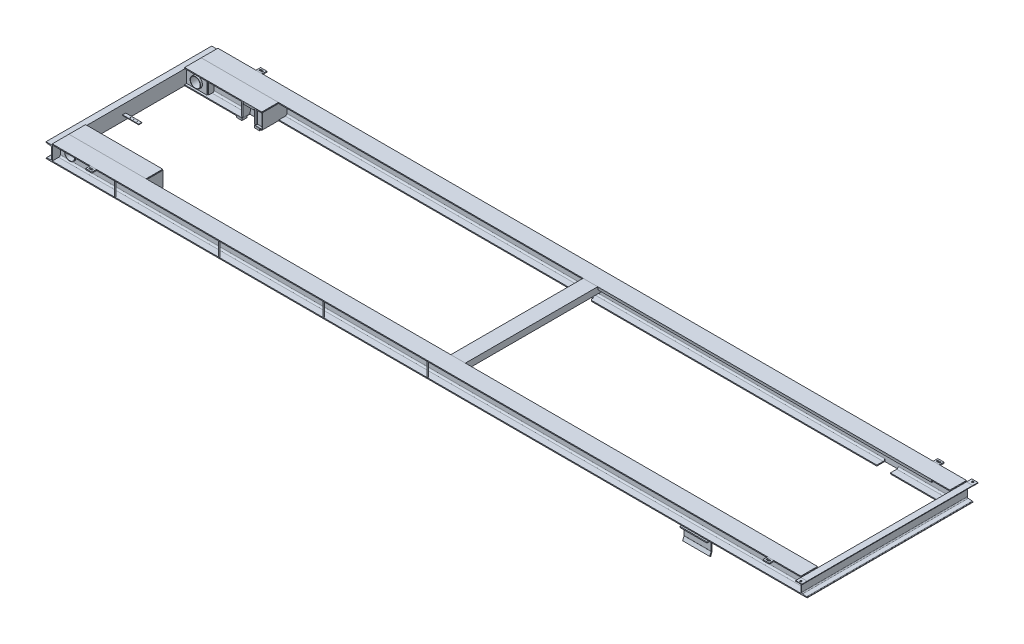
SolidWorks part; units mm, degrees
ref_plane "Plan de face" through (0, 0, 0) normal (0, 0, 1) x (1, 0, 0)
ref_plane "Plan de dessus" through (0, 0, 0) normal (0, 1, 0) x (1, 0, 0)
ref_plane "Plan de droite" through (0, 0, 0) normal (1, 0, 0) x (0, 0, -1)
sketch3d "Esquisse3D1"
  line L0 (0, 0, 795) -> (0, 0, -795)
  line L1 (0, 0, 795) -> (7185, 0, 795)
  line L2 (7185, 0, 795) -> (7185, 0, -795)
  line L3 (7185, 0, -795) -> (0, 0, -795)
  line L4 (0, 0, 635) -> (740.5, 0, 635)
  line L5 (0, 0, -635) -> (740.5, 0, -635)
  point P2 (0, 0, 0)
  dimension "D1" = 1590
  dimension "D2" = 7185
  dimension "D3" = 1270
  dimension "D4" = 635
  dimension "D5" = 740.5
other "Elément mécano-soudé1"
ref_plane "Plan1" through (0, 0, 795) normal (1, 0, 0) x (0, 0, -1)
sketch "Esquisse2" plane through (0, 0, 715) normal (1, 0, 0) x (0, 0, -1)
  line L0 (0, 152) -> (0, 0) construction
  line L1 (80, 0) -> (-80, 0)
  line L2 (-80, 0) -> (-80, 9)
  line L3 (-80, 9) -> (-18, 9)
  line L4 (-3, 24) -> (-3, 128)
  line L5 (-18, 143) -> (-80, 143)
  line L6 (-80, 143) -> (-80, 152)
  line L7 (-80, 152) -> (80, 152)
  line L8 (80, 143) -> (80, 152)
  line L9 (18, 143) -> (80, 143)
  line L10 (3, 24) -> (3, 128)
  line L11 (80, 9) -> (18, 9)
  line L12 (80, 0) -> (80, 9)
  arc A0 (-18, 9) -> (-3, 24) centre (-18, 24) ccw
  arc A1 (-3, 128) -> (-18, 143) centre (-18, 128) ccw
  arc A2 (3, 128) -> (18, 143) centre (18, 128) cw
  arc A3 (18, 9) -> (3, 24) centre (18, 24) cw
  point P2 (0, 76)
  point P22 (0, 152)
  point P25 (0, 0)
  point P26 (-80, 76)
  point P27 (80, 76)
  point P28 (0, 0)
  dimension "D5" = 15
  dimension "D1" = 6
  dimension "D3" = 160
  dimension "D6" = 152
  dimension "D7" = 9
other "Elément mécano-soudé2"
ref_plane "Plan2" through (7185, 0, -795) normal (-1, 0, 0) x (0, 0, 1)
sketch "Esquisse21" plane through (7185, 0, -715) normal (-1, 0, 0) x (0, 0, 1)
  line L0 (0, 152) -> (0, 0) construction
  line L1 (80, 0) -> (-80, 0)
  line L2 (-80, 0) -> (-80, 9)
  line L3 (-80, 9) -> (-18, 9)
  line L4 (-3, 24) -> (-3, 128)
  line L5 (-18, 143) -> (-80, 143)
  line L6 (-80, 143) -> (-80, 152)
  line L7 (-80, 152) -> (80, 152)
  line L8 (80, 143) -> (80, 152)
  line L9 (18, 143) -> (80, 143)
  line L10 (3, 24) -> (3, 128)
  line L11 (80, 9) -> (18, 9)
  line L12 (80, 0) -> (80, 9)
  arc A0 (-18, 9) -> (-3, 24) centre (-18, 24) ccw
  arc A1 (-3, 128) -> (-18, 143) centre (-18, 128) ccw
  arc A2 (3, 128) -> (18, 143) centre (18, 128) cw
  arc A3 (18, 9) -> (3, 24) centre (18, 24) cw
  point P2 (0, 76)
  point P22 (0, 152)
  point P25 (0, 0)
  point P26 (-80, 76)
  point P27 (80, 76)
  point P28 (0, 0)
  dimension "D5" = 15
  dimension "D1" = 6
  dimension "D3" = 160
  dimension "D6" = 152
  dimension "D7" = 9
other "Elément mécano-soudé3"
ref_plane "Plan3" through (0, 0, -635) normal (1, 0, 0) x (0, 0, -1)
sketch "Esquisse22" plane through (0, 0, -555) normal (1, 0, 0) x (0, 0, -1)
  line L0 (0, 152) -> (0, 0) construction
  line L1 (80, 0) -> (-80, 0)
  line L2 (-80, 0) -> (-80, 9)
  line L3 (-80, 9) -> (-18, 9)
  line L4 (-3, 24) -> (-3, 128)
  line L5 (-18, 143) -> (-80, 143)
  line L6 (-80, 143) -> (-80, 152)
  line L7 (-80, 152) -> (80, 152)
  line L8 (80, 143) -> (80, 152)
  line L9 (18, 143) -> (80, 143)
  line L10 (3, 24) -> (3, 128)
  line L11 (80, 9) -> (18, 9)
  line L12 (80, 0) -> (80, 9)
  arc A0 (-18, 9) -> (-3, 24) centre (-18, 24) ccw
  arc A1 (-3, 128) -> (-18, 143) centre (-18, 128) ccw
  arc A2 (3, 128) -> (18, 143) centre (18, 128) cw
  arc A3 (18, 9) -> (3, 24) centre (18, 24) cw
  point P2 (0, 76)
  point P22 (0, 152)
  point P25 (0, 0)
  point P26 (-80, 76)
  point P27 (80, 76)
  point P28 (0, 0)
  dimension "D5" = 15
  dimension "D1" = 6
  dimension "D3" = 160
  dimension "D6" = 152
  dimension "D7" = 9
other "Elément mécano-soudé4"
ref_plane "Plan4" through (0, 0, 635) normal (1, 0, 0) x (0, 0, -1)
sketch "Esquisse23" plane through (0, 0, 555) normal (1, 0, 0) x (0, 0, -1)
  line L0 (0, 152) -> (0, 0) construction
  line L1 (80, 0) -> (-80, 0)
  line L2 (-80, 0) -> (-80, 9)
  line L3 (-80, 9) -> (-18, 9)
  line L4 (-3, 24) -> (-3, 128)
  line L5 (-18, 143) -> (-80, 143)
  line L6 (-80, 143) -> (-80, 152)
  line L7 (-80, 152) -> (80, 152)
  line L8 (80, 143) -> (80, 152)
  line L9 (18, 143) -> (80, 143)
  line L10 (3, 24) -> (3, 128)
  line L11 (80, 9) -> (18, 9)
  line L12 (80, 0) -> (80, 9)
  arc A0 (-18, 9) -> (-3, 24) centre (-18, 24) ccw
  arc A1 (-3, 128) -> (-18, 143) centre (-18, 128) ccw
  arc A2 (3, 128) -> (18, 143) centre (18, 128) cw
  arc A3 (18, 9) -> (3, 24) centre (18, 24) cw
  point P2 (0, 76)
  point P22 (0, 152)
  point P25 (0, 0)
  point P26 (-80, 76)
  point P27 (80, 76)
  point P28 (0, 0)
  dimension "D5" = 15
  dimension "D1" = 6
  dimension "D3" = 160
  dimension "D6" = 152
  dimension "D7" = 9
other "Elément mécano-soudé5"
ref_plane "Plan5" through (0, 0, 795) normal (0, 0, -1) x (-1, 0, 0)
sketch "Esquisse1" plane through (0, 0, 795) normal (0, 0, -1) x (-1, 0, 0)
  line L0 (60, 140) -> (0, 140)
  line L1 (60, 0) -> (0, 0)
  line L2 (0, 140) -> (0, 0)
  line L3 (60, 140) -> (60, 136.8833)
  line L4 (60, 0) -> (60, 3.1167)
  line L5 (7, 119) -> (7, 21)
  line L6 (16.2543, 128.9722) -> (55.3728, 131.8973)
  line L7 (16.2543, 11.0278) -> (55.3728, 8.1027)
  arc A0 (7, 21) -> (16.2543, 11.0278) centre (17, 21) ccw
  arc A1 (7, 119) -> (16.2543, 128.9722) centre (17, 119) cw
  arc A2 (60, 3.1167) -> (55.3728, 8.1027) centre (55, 3.1167) ccw
  arc A3 (60, 136.8833) -> (55.3728, 131.8973) centre (55, 136.8833) cw
  point P15 (60, 132.2433)
  point P18 (60, 7.7567)
  point P19 (0, 70)
  point P20 (7, 70)
  point P21 (30, 140)
  point P22 (30, 0)
  point P23 (0, 140)
  point P24 (0, 0)
  point P25 (7, 128.2802)
  point P26 (30, 130)
  point P27 (30, 70)
  point P28 (60, 70)
  point P29 (7, 11.7198)
  point P30 (30, 10)
  point P31 (0, 0)
  dimension "D1" = 140
  dimension "D2" = 98
  dimension "D8" = 5
  dimension "D7" = 10
  dimension "D9" = 11.0278
  dimension "D3" = 60
  dimension "D4" = 10
  dimension "D5" = 10
  dimension "D6" = 7
other "Elément mécano-soudé6"
ref_plane "Plan6" through (7185, 0, 795) normal (0, 0, -1) x (-1, 0, 0)
sketch "Esquisse11" plane through (7185, 140, 795) normal (0, 0, -1) x (1, 0, 0)
  line L0 (60, 140) -> (0, 140)
  line L1 (60, 0) -> (0, 0)
  line L2 (0, 140) -> (0, 0)
  line L3 (60, 140) -> (60, 136.8833)
  line L4 (60, 0) -> (60, 3.1167)
  line L5 (7, 119) -> (7, 21)
  line L6 (16.2543, 128.9722) -> (55.3728, 131.8973)
  line L7 (16.2543, 11.0278) -> (55.3728, 8.1027)
  arc A0 (7, 21) -> (16.2543, 11.0278) centre (17, 21) ccw
  arc A1 (7, 119) -> (16.2543, 128.9722) centre (17, 119) cw
  arc A2 (60, 3.1167) -> (55.3728, 8.1027) centre (55, 3.1167) ccw
  arc A3 (60, 136.8833) -> (55.3728, 131.8973) centre (55, 136.8833) cw
  point P15 (60, 132.2433)
  point P18 (60, 7.7567)
  point P19 (0, 70)
  point P20 (7, 70)
  point P21 (30, 140)
  point P22 (30, 0)
  point P23 (0, 140)
  point P24 (0, 0)
  point P25 (7, 128.2802)
  point P26 (30, 130)
  point P27 (30, 70)
  point P28 (60, 70)
  point P29 (7, 11.7198)
  point P30 (30, 10)
  point P31 (0, 0)
  dimension "D1" = 140
  dimension "D2" = 98
  dimension "D8" = 5
  dimension "D7" = 10
  dimension "D9" = 11.0278
  dimension "D3" = 60
  dimension "D4" = 10
  dimension "D5" = 10
  dimension "D6" = 7
sketch3d "Esquisse3D2"
  line L0 (3805, 152, 795) -> (3805, 152, -795)
  line L1 (7185, 152, 795) -> (0, 152, 795) construction
  line L2 (0, 152, -795) -> (7185, 152, -795) construction
  dimension "D1" = 3380
other "Elément mécano-soudé7"
ref_plane "Plan7" through (3805, 152, 795) normal (0, 0, -1) x (-1, 0, 0)
sketch "Esquisse12" plane through (3805, 152, 795) normal (0, 0, -1) x (0, -1, 0)
  line L0 (60, 140) -> (0, 140)
  line L1 (60, 0) -> (0, 0)
  line L2 (0, 140) -> (0, 0)
  line L3 (60, 140) -> (60, 136.8833)
  line L4 (60, 0) -> (60, 3.1167)
  line L5 (7, 119) -> (7, 21)
  line L6 (16.2543, 128.9722) -> (55.3728, 131.8973)
  line L7 (16.2543, 11.0278) -> (55.3728, 8.1027)
  arc A0 (7, 21) -> (16.2543, 11.0278) centre (17, 21) ccw
  arc A1 (7, 119) -> (16.2543, 128.9722) centre (17, 119) cw
  arc A2 (60, 3.1167) -> (55.3728, 8.1027) centre (55, 3.1167) ccw
  arc A3 (60, 136.8833) -> (55.3728, 131.8973) centre (55, 136.8833) cw
  point P15 (60, 132.2433)
  point P18 (60, 7.7567)
  point P19 (0, 70)
  point P20 (7, 70)
  point P21 (30, 140)
  point P22 (30, 0)
  point P23 (0, 140)
  point P24 (0, 0)
  point P25 (7, 128.2802)
  point P26 (30, 130)
  point P27 (30, 70)
  point P28 (60, 70)
  point P29 (7, 11.7198)
  point P30 (30, 10)
  point P31 (0, 0)
  dimension "D1" = 140
  dimension "D2" = 98
  dimension "D8" = 5
  dimension "D7" = 10
  dimension "D9" = 11.0278
  dimension "D3" = 60
  dimension "D4" = 10
  dimension "D5" = 10
  dimension "D6" = 7
other "Ajuster/Prolonger1"
sketch3d "Esquisse3D3"
  line L0 (3805, 143, 640) -> (7005, 143, 640)
  dimension "D1" = 3200
  dimension "D2" = 5
other "Elément mécano-soudé8"
ref_plane "Plan8" through (3805, 143, 640) normal (1, 0, 0) x (0, 0, -1)
sketch "Esquisse13" plane through (3805, 123, 665) normal (1, 0, 0) x (0, 0, -1)
  line L1 (-25, 0) -> (25, 0)
  line L2 (-25, 0) -> (-25, 20)
  line L3 (-25, 20) -> (25, 20)
  line L4 (25, 0) -> (25, 20)
  point P4 (0, 0)
  point P5 (0, 0)
  dimension "D1" = 20
  dimension "D2" = 50
sketch "Esquisse24" plane through (0, 0, 0) normal (0, -1, 0) x (1, 0, 0)
  line L0 (740.5, 475) -> (0, 475) construction
  line L1 (670, 475) -> (550, 475)
  line L2 (670, 475) -> (670, 552)
  line L3 (670, 552) -> (550, 552)
  line L4 (550, 475) -> (550, 552)
  line L5 (0, 795) -> (0, -795) construction
  dimension "D1" = 120
  dimension "D2" = 77
  dimension "D3" = 550
extrude "Enlèv. mat.-Extru.1" cut sketch "Esquisse24" against normal blind 30
inserted part "CA2502-6"
move or copy body "Corps-Déplacer/Copier2" placed by mates yes
other "<CA2502-6>-<Chanfrein1>"
inserted part "CA2502-5"
move or copy body "Corps-Déplacer/Copier4" placed by mates yes
other "Distance1" parameters "D1"=4.5
other "<CA2502-5>-<Chanfrein1>"
inserted part "CA2502-52"
move or copy body "Corps-Déplacer/Copier6" placed by mates yes
other "Distance2" parameters "D1"=111
other "<CA2502-5>-<Chanfrein1>"
inserted part "CA2502-8"
move or copy body "Corps-Déplacer/Copier8" placed by mates yes
other "Distance3" parameters "D1"=20
other "<CA2502-8>-<Extrusion1>"
inserted part "OB2865"
move or copy body "Corps-Déplacer/Copier10" placed by mates yes
other "Distance4" parameters "D1"=4.5
other "<OB2865>-<Trou taraudé M121>"
pattern_linear "Répétition linéaire1" count 2 spacing 170
inserted part "CA2600-240"
move or copy body "Corps-Déplacer/Copier12" placed by mates yes
other "<CA2600-240>-<Enlèv. mat.-Extru.1>"
sketch "Esquisse25" plane through (0, 0, 552) normal (0, 0, -1) x (-1, 0, 0)
  circle A0 centre (-100, 75.5) radius 51.5
  circle A1 centre (-100, 75.5) radius 51.5 construction
extrude "Enlèv. mat.-Extru.2" cut sketch "Esquisse25" against normal up to surface (166 mm away)
inserted part "CA2502-23"
move or copy body "Corps-Déplacer/Copier14" placed by mates yes
other "Distance5" parameters "D1"=10
other "<CA2502-23>-<Extrusion1>"
inserted part "OB0183"
move or copy body "Corps-Déplacer/Copier16" placed by mates yes
other "Distance6" parameters "D1"=425
other "<OB0183>-<Enlèv. mat.-Extru.1>"
pattern_linear "Répétition linéaire2" count 2 spacing 6500
sketch "Esquisse26" plane through (0, 0, 0) normal (0, -1, 0) x (1, 0, 0)
  line L0 (7185, 795) -> (7185, 635) construction
  line L1 (6613.65, 635) -> (6483.65, 635)
  line L2 (6613.65, 635) -> (6613.65, 712)
  line L3 (6613.65, 712) -> (6483.65, 712)
  line L4 (6483.65, 635) -> (6483.65, 712)
  line L6 (7185, 635) -> (0, 635) construction
  dimension "D1" = 130
  dimension "D2" = 77
  dimension "D3" = 571.35
extrude "Enlèv. mat.-Extru.3" cut sketch "Esquisse26" against normal blind 30
ref_plane "Plan9" through (6298.65, 0, 0) normal (-1, 0, 0) x (0, 0, 1)
sketch "Esquisse27" plane through (6298.65, 0, 0) normal (-1, 0, 0) x (0, 0, 1)
  line L0 (810, 0) -> (760, 0)
  line L1 (795, 0) -> (-795, 0) construction
  line L2 (760, 0) -> (760, -100)
  line L3 (760, -100) -> (773.6808, -137.5877)
  line L4 (0, -91.85) -> (0, 91.85) construction
  dimension "D1" = 50
  dimension "D2" = 100
  dimension "D3" = 40
  dimension "D4" = 20
  dimension "D5" = 760
extrude "Extru.-Mince1" add sketch "Esquisse27" along normal blind 260 separate body thin
sketch3d "Esquisse3D5"
  line L0 (7230, 140, 742) -> (7230, 140, 842)
  line L1 (7185, 140, 795) -> (7245, 140, 795) construction
  dimension "D1" = 100
  dimension "D2" = 47
  dimension "D3" = 45
sketch3d "Esquisse3D9"
  line L0 (7005, 133, 712) -> (3805, 133, 712)
  dimension "D1" = 10
other "Elément mécano-soudé13"
ref_plane "Plan14" through (7005, 133, 712) normal (-1, 0, 0) x (0, 0, 1)
sketch "Esquisse17" plane through (7005, 123, 702) normal (-1, 0, 0) x (0, 0, 1)
  line L1 (-10, 10) -> (10, 10)
  line L2 (-10, 10) -> (-10, -10)
  line L3 (-10, -10) -> (10, -10)
  line L4 (10, 10) -> (10, -10)
  point P4 (0, -10)
  point P6 (10, 0)
  point P7 (-10, 0)
  point P8 (0, 10)
  point P9 (0, 0)
  dimension "D1" = 20
mirror "Symétrie1" about plane through (0, 0, 0) normal (0, 0, 1)
sketch "Esquisse30" plane through (0, 0, 0) normal (0, -1, 0) x (1, 0, 0)
  line L0 (0, -635) -> (7185, -635) construction
  line L1 (6613.65, -712) -> (6483.65, -712)
  line L2 (6613.65, -712) -> (6613.65, -635)
  line L3 (6613.65, -635) -> (6483.65, -635)
  line L4 (6483.65, -712) -> (6483.65, -635)
  line L5 (6613.65, 635) -> (6613.65, 712) construction
  dimension "D1" = 130
  dimension "D2" = 77
extrude "Enlèv. mat.-Extru.12" cut sketch "Esquisse30" against normal blind 30
sketch3d "Esquisse3D6"
  line L0 (265, 0, 775) -> (265, 0, 655)
  line L3 (0, 0, -795) -> (0, 0, 795) construction
  dimension "D1" = 265
  dimension "D2" = 20
  dimension "D3" = 120
other "Elément mécano-soudé10"
ref_plane "Plan11" through (265, 0, 775) normal (0, 0, -1) x (-1, 0, 0)
sketch "Esquisse28" plane through (265, 0, 775) normal (0, 0, -1) x (1, 0, 0)
  line L0 (-11.5, 0) -> (11.5, 0)
  line L1 (-14, 2.5) -> (-14, 8.5)
  line L2 (14, 2.5) -> (14, 8.5)
  line L3 (-11.5, 11) -> (-6, 11)
  line L4 (11.5, 11) -> (6, 11)
  line L5 (11.5, 9) -> (6, 9)
  line L6 (12, 2.5) -> (12, 8.5)
  line L7 (-11.5, 2) -> (11.5, 2)
  line L8 (-12, 2.5) -> (-12, 8.5)
  line L9 (-11.5, 9) -> (-6, 9)
  line L10 (-6, 9) -> (-6, 11)
  line L11 (6, 9) -> (6, 11)
  arc A0 (-11.5, 0) -> (-14, 2.5) centre (-11.5, 2.5) cw
  arc A1 (-14, 8.5) -> (-11.5, 11) centre (-11.5, 8.5) cw
  arc A2 (14, 8.5) -> (11.5, 11) centre (11.5, 8.5) ccw
  arc A3 (11.5, 0) -> (14, 2.5) centre (11.5, 2.5) ccw
  arc A4 (12, 8.5) -> (11.5, 9) centre (11.5, 8.5) ccw
  arc A5 (11.5, 2) -> (12, 2.5) centre (11.5, 2.5) ccw
  arc A6 (-11.5, 2) -> (-12, 2.5) centre (-11.5, 2.5) cw
  arc A7 (-12, 8.5) -> (-11.5, 9) centre (-11.5, 8.5) cw
  point P3 (0, 0)
  point P10 (-14, 0)
  point P13 (-14, 11)
  point P18 (14, 0)
  point P33 (0, 11)
  point P34 (0, 0)
  dimension "D4" = 2.5
  dimension "D5" = 2.5
  dimension "D1" = 28
  dimension "D2" = 11
  dimension "D3" = 8
  dimension "D6" = 2
sketch3d "Esquisse3D7"
  line L0 (600, 143, 790) -> (600, 9, 790)
  dimension "D1" = 5
  dimension "D2" = 600
other "Elément mécano-soudé11"
ref_plane "Plan12" through (600, 143, 790) normal (0, -1, 0) x (1, 0, 0)
sketch "Esquisse15" plane through (600, 143, 790) normal (0, -1, 0) x (1, 0, 0)
  circle A0 centre (0, 0) radius 5
  point P3 (0, 0)
  dimension "D1" = 10
pattern_linear "Répétition linéaire3" count 4 spacing 1000 along (1, 0, 0)
sketch3d "Esquisse3D8"
  line L0 (0, 50, 105) -> (155, 50, 105)
  dimension "D1" = 690
  dimension "D2" = 50
  dimension "D3" = 155
other "Elément mécano-soudé12"
ref_plane "Plan13" through (0, 50, 105) normal (1, 0, 0) x (0, 0, -1)
sketch "Esquisse16" plane through (0, 56, 120) normal (1, 0, 0) x (0, -1, 0)
  line L1 (0, 0) -> (6, 0)
  line L2 (0, 0) -> (0, 30)
  line L3 (0, 30) -> (6, 30)
  line L4 (6, 0) -> (6, 30)
  point P5 (0, 15)
  point P6 (3, 0)
  point P7 (6, 15)
  point P8 (3, 30)
  point P9 (3, 15)
  point P10 (0, 0)
  dimension "D1" = 6
  dimension "D2" = 30
sketch "Esquisse32" plane through (0, 56, 0) normal (0, 1, 0) x (1, 0, 0)
  line L0 (0, -105) -> (155, -105) construction
  line L1 (155, -90) -> (155, -120) construction
  circle A0 centre (62, -105) radius 3
  circle A1 centre (92, -105) radius 3
  circle A2 centre (125, -105) radius 3
  dimension "D2" = 33
  dimension "D3" = 30
  dimension "D4" = 6
  dimension "D1" = 30
extrude "Enlèv. mat.-Extru.14" cut sketch "Esquisse32" against normal up to surface (6 mm away)
sketch "Esquisse36" plane through (0, 140, 0) normal (0, 1, 0) x (1, 0, 0)
  line L0 (7215, -795) -> (7215, -845)
  line L3 (7245, 795) -> (7245, -795) construction
  dimension "D1" = 50
  dimension "D2" = 30
other "Elément mécano-soudé16"
ref_plane "Plan18" through (7215, 140, 795) normal (0, 0, 1) x (1, 0, 0)
sketch "Esquisse115" plane through (7215, 140, 795) normal (0, 0, 1) x (-1, 0, 0)
  line L1 (-30, 6) -> (30, 6)
  line L2 (-30, 6) -> (-30, 0)
  line L3 (-30, 0) -> (30, 0)
  line L4 (30, 6) -> (30, 0)
  point P4 (0, 0)
  point P6 (0, 0)
  dimension "D1" = 60
  dimension "D2" = 6
sketch "Esquisse113" plane through (0, 140, 0) normal (0, 1, 0) x (1, 0, 0)
  line L0 (7245, 795) -> (7245, -795) construction
  line L1 (7245, -845) -> (7185, -845) construction
  circle A0 centre (7215, -825) radius 8.5
  dimension "D1" = 17
  dimension "D2" = 30
  dimension "D3" = 20
extrude "Enlèv. mat.-Extru.16" cut sketch "Esquisse113" against normal blind 10
mirror "Symétrie3" about plane through (0, 0, 0) normal (0, 0, 1)
sketch "Esquisse116" plane through (0, 0, 0) normal (0, -1, 0) x (1, 0, 0)
  line L0 (740.5, -475) -> (0, -475) construction
  line L1 (550, -475) -> (670, -475)
  line L2 (550, -475) -> (550, -552)
  line L3 (550, -552) -> (670, -552)
  line L4 (670, -475) -> (670, -552)
  line L5 (0, -795) -> (0, 795) construction
  dimension "D1" = 77
  dimension "D2" = 550
  dimension "D3" = 120
extrude "Enlèv. mat.-Extru.17" cut sketch "Esquisse116" against normal blind 30
mirror "Symétrie4" about plane through (0, 0, 0) normal (0, 0, 1) of "Enlèv. mat.-Extru.2"
mirror "Symétrie5" about plane through (0, 0, 0) normal (0, 0, 1)
sketch "Esquisse117" plane through (0, 0, 0) normal (0, -1, 0) x (1, 0, 0)
  line L0 (6483.65, 635) -> (0, 635) construction
  line L1 (3575, 635) -> (3735, 635)
  line L2 (3575, 635) -> (3575, 665)
  line L3 (3575, 665) -> (3735, 665)
  line L4 (3735, 635) -> (3735, 665)
  line L6 (3665, -712) -> (3665, 712) construction
  dimension "D1" = 160
  dimension "D2" = 90
  dimension "D3" = 30
extrude "Enlèv. mat.-Extru.18" cut sketch "Esquisse117" against normal blind 10
chamfer "Chanfrein1" distance 10 angle 45 2 edges at (3735, 4.5, 635) (3575, 4.5, 635)
mirror "Symétrie7" about plane through (0, 0, 0) normal (0, 0, 1) of "Enlèv. mat.-Extru.18", "Chanfrein1"
sketch "Esquisse118" plane through (0, 143, 0) normal (0, -1, 0) x (1, 0, 0)
  line L0 (660, 532) -> (560, 532)
  line L1 (554.5, 482) -> (554.5, 537) construction
  line L4 (539.5, 482) -> (554.5, 482) construction
  dimension "D1" = 100
  dimension "D2" = 5.5
  dimension "D3" = 50
other "Elément mécano-soudé17"
ref_plane "Plan19" through (660, 143, 532) normal (-1, 0, 0) x (0, 0, 1)
sketch "Esquisse120" plane through (660, 123, 507) normal (-1, 0, 0) x (0, 0, 1)
  line L1 (-25, 0) -> (25, 0)
  line L2 (-25, 0) -> (-25, 20)
  line L3 (-25, 20) -> (25, 20)
  line L4 (25, 0) -> (25, 20)
  point P4 (0, 0)
  point P5 (0, 0)
  dimension "D1" = 20
  dimension "D2" = 50
mirror "Symétrie8" about plane through (0, 0, 0) normal (0, 0, 1)
ref_plane "Plan21" through (0, 0, 502) normal (0, 0, -1) x (-1, 0, 0)
sketch "Esquisse124" plane through (0, 0, 502) normal (0, 0, -1) x (-1, 0, 0)
  line L0 (-195, 142) -> (-195, 12)
  line L1 (-195, 9) -> (-195, 142) construction
  dimension "D1" = 130
other "Elément mécano-soudé19"
ref_plane "Plan23" through (195, 142, 502) normal (0, -1, 0) x (1, 0, 0)
sketch "Esquisse126" plane through (195, 142, 552) normal (0, -1, 0) x (0, 0, -1)
  line L1 (0, 0) -> (50, 0)
  line L2 (0, 0) -> (0, 10)
  line L3 (0, 10) -> (50, 10)
  line L4 (50, 0) -> (50, 10)
  point P5 (0, 0)
  dimension "D1" = 50
  dimension "D2" = 10
mirror "Symétrie9" about plane through (0, 0, 0) normal (0, 0, 1)
equation "\"D4@Esquisse3D1\" = \"D3@Esquisse3D1\" / 2"
